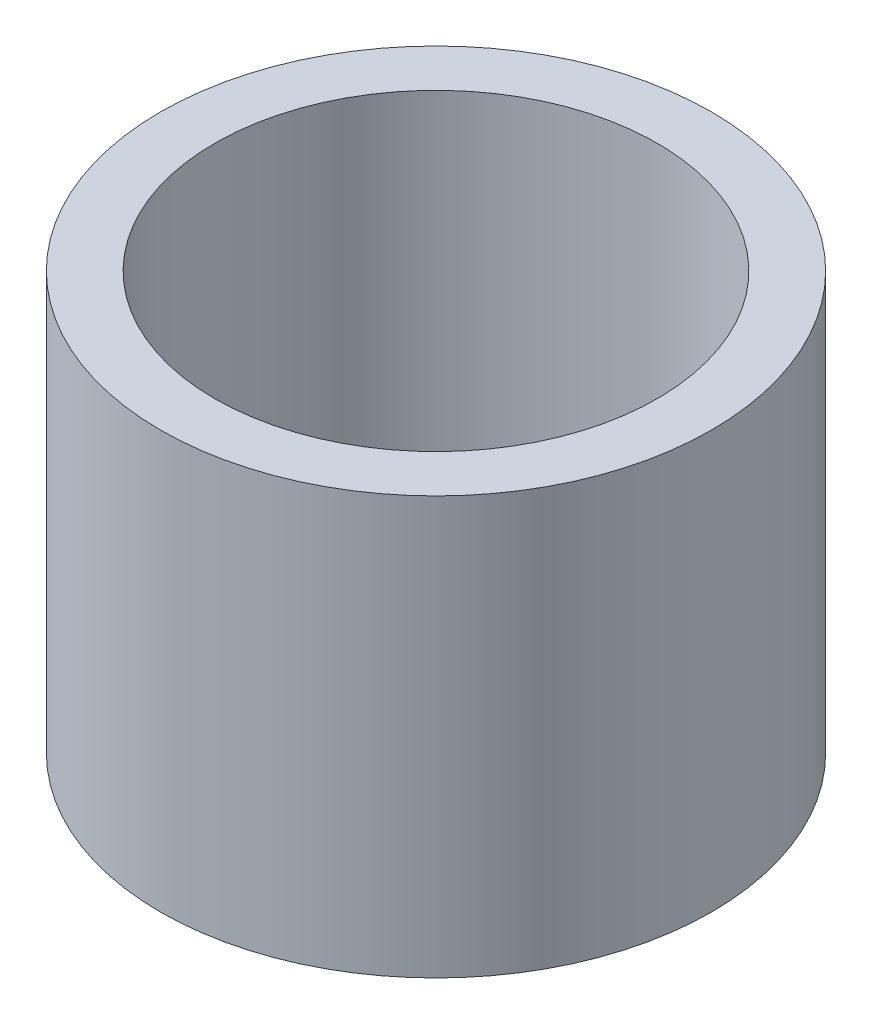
SolidWorks part; units mm, degrees
ref_plane "Front Plane" through (0, 0, 0) normal (0, 0, 1) x (1, 0, 0)
ref_plane "Top Plane" through (0, 0, 0) normal (0, 1, 0) x (1, 0, 0)
ref_plane "Right Plane" through (0, 0, 0) normal (1, 0, 0) x (0, 0, -1)
sketch "Sketch1" plane through (0, 0, 0) normal (0, 1, 0) x (1, 0, 0)
  circle A0 centre (0, 0) radius 3.3
  circle A1 centre (0, 0) radius 2.65
extrude "Boss-Extrude1" add sketch "Sketch1" along normal blind 5
